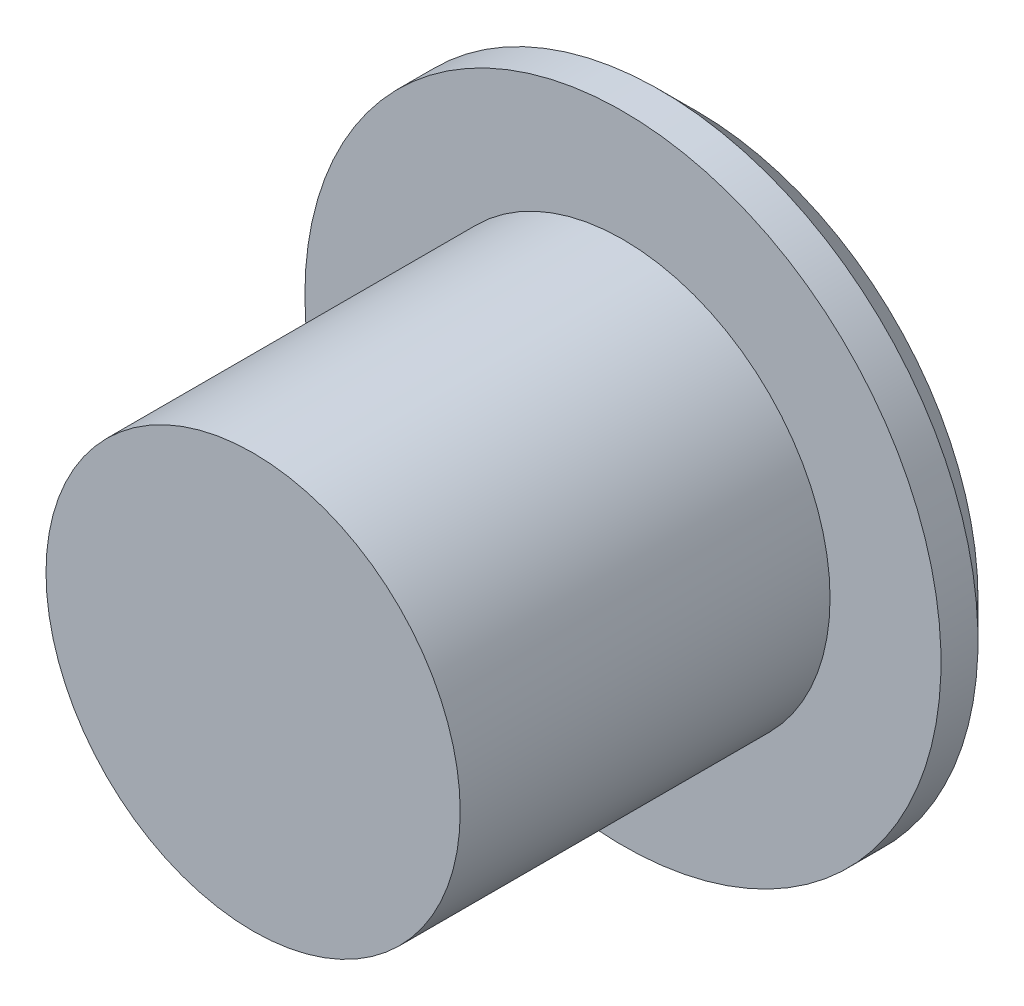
SolidWorks part; units mm, degrees
ref_plane "Plan de face" through (0, 0, 0) normal (0, 0, 1) x (1, 0, 0)
ref_plane "Plan de dessus" through (0, 0, 0) normal (0, 1, 0) x (1, 0, 0)
ref_plane "Plan de droite" through (0, 0, 0) normal (1, 0, 0) x (0, 0, -1)
sketch "Esquisse1" plane through (0, 0, 0) normal (0, 0, 1) x (1, 0, 0)
  circle A0 centre (0, 0) radius 2.8
  dimension "D1" = 5.6
extrude "Boss.-Extru.2" add sketch "Esquisse1" along normal blind 5
sketch "Esquisse2" plane through (0, 0, 0) normal (0, 0, -1) x (-1, 0, 0)
  circle A2 centre (0, 0) radius 4.3
  circle A3 centre (0, 0) radius 4.3
  dimension "D1" = 1.5
extrude "Boss.-Extru.3" add sketch "Esquisse2" along normal blind 1
chamfer "Chanfrein1" distance 0.5 angle 45 1 edges at (-4.3, 0, -1)
